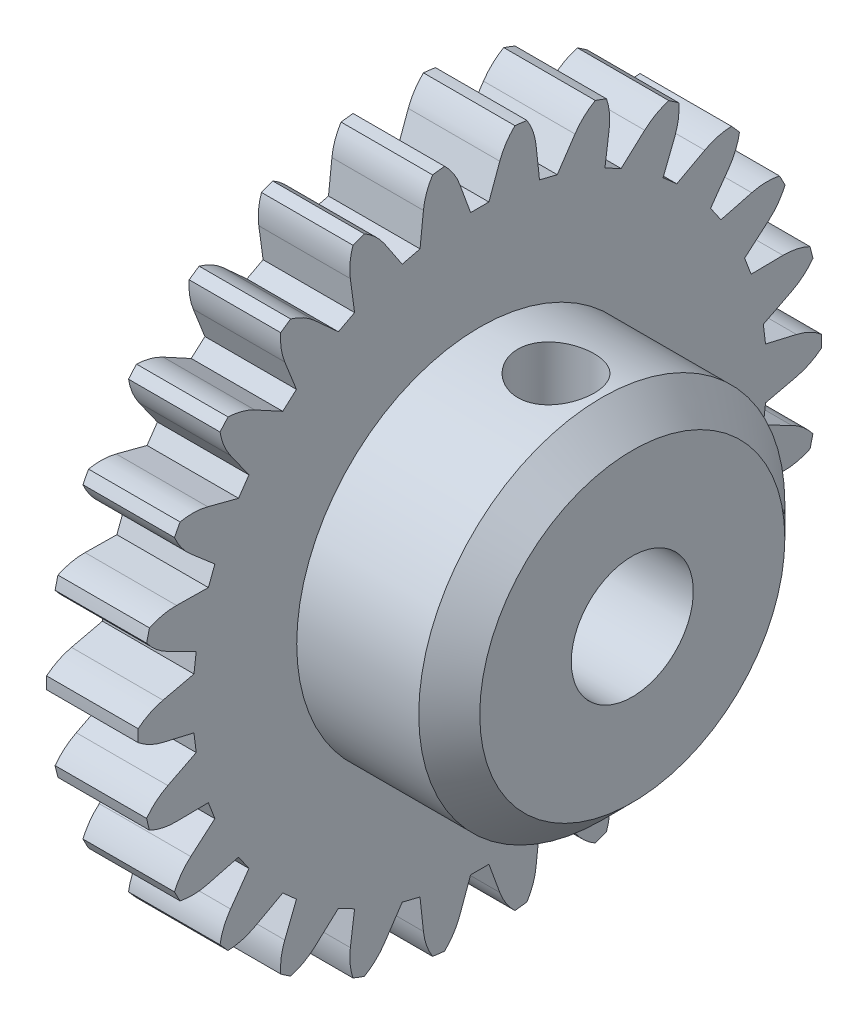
SolidWorks part; units mm, degrees
ref_plane "Plan de face" through (0, 0, 0) normal (0, 0, 1) x (1, 0, 0)
ref_plane "Plan de dessus" through (0, 0, 0) normal (0, 1, 0) x (1, 0, 0)
ref_plane "Plan de droite" through (0, 0, 0) normal (1, 0, 0) x (0, 0, -1)
sketch "Esquisse1" plane through (0, 0, 0) normal (0, 0, 1) x (1, 0, 0)
  line L0 (-19.4483, 0) -> (45.9971, 0) construction
  line L1 (0, 2) -> (8, 2)
  line L3 (0, 2) -> (0, 11.2)
  line L4 (0, 11.2) -> (3, 11.2)
  line L5 (3, 6) -> (3, 11.2)
  line L6 (3, 6) -> (8, 6)
  line L9 (8, 6) -> (8, 2)
  dimension "D1" = 2
  dimension "D2" = 3
  dimension "D3" = 5
  dimension "D4" = 11.2
  dimension "D5" = 4
revolve "Révolution1" add sketch "Esquisse1" angle 360 about L0
sketch "Esquisse2" plane through (0, 0, 0) normal (-1, 0, 0) x (0, 0, 1)
  line L0 (0, 17.9781) -> (0, -0.7899) construction
  line L1 (1.3518, 11.3071) -> (-1.3518, 11.3071)
  line L2 (0.6564, 10.3793) -> (0.3, 9.4)
  line L3 (0.3, 9.4) -> (-0.3, 9.4)
  line L4 (-0.3, 9.4) -> (-0.6564, 10.3793)
  arc A0 (1.3518, 11.3071) -> (0.6564, 10.3793) centre (2.5358, 9.6952) ccw
  circle A1 centre (0, 0) radius 10.4 construction
  arc A2 (-0.6564, 10.3793) -> (-1.3518, 11.3071) centre (-2.5358, 9.6952) ccw
  dimension "D6" = 20.8
  dimension "D3" = 4
  dimension "D4" = 4
  dimension "D1" = 70
  dimension "D2" = 70
  dimension "D5" = 0.3
extrude "Enlèv. mat.-Extru.1" cut sketch "Esquisse2" against normal through all
pattern_circular "Répétition circulaire1" count 26 over 360 about axis through (0, 0, 0) along (1, 0, 0) of "Enlèv. mat.-Extru.1"
chamfer "Chanfrein1" distance 1 angle 45 1 edges at (8, 0, 6)
sketch "Esquisse3" plane through (0, 0, 0) normal (0, 1, 0) x (1, 0, 0)
  line L0 (7, 0) -> (3, 0) construction
  circle A0 centre (5.5, 0) radius 1.25
  dimension "D1" = 2.5
  dimension "D2" = 5.5
extrude "Enlèv. mat.-Extru.2" cut sketch "Esquisse3" along normal blind 20
